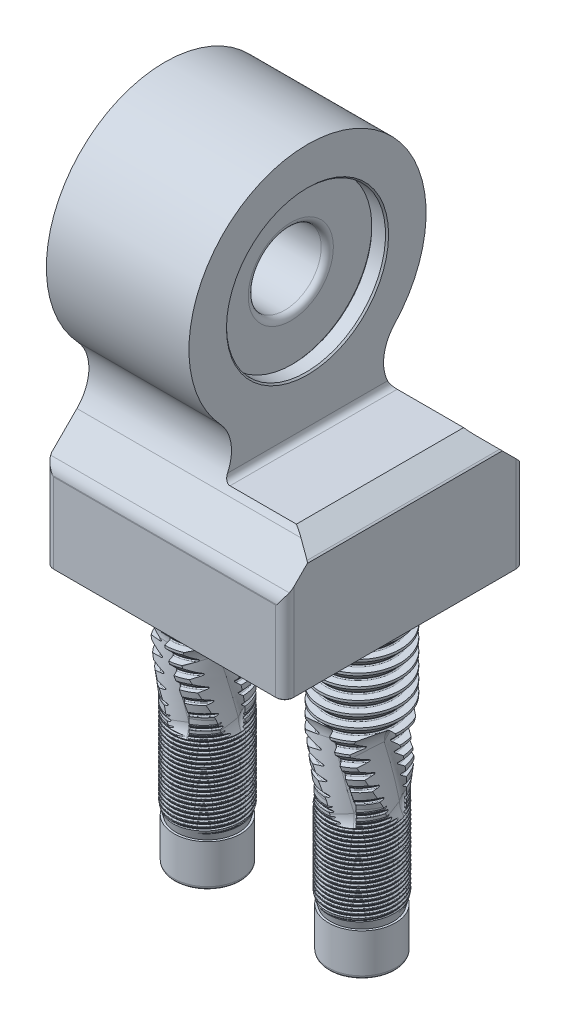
SolidWorks part; units mm, degrees
ref_plane "Front" through (0, 0, 0) normal (0, 0, 1) x (1, 0, 0)
ref_plane "Top" through (0, 0, 0) normal (0, 1, 0) x (1, 0, 0)
ref_plane "Right" through (0, 0, 0) normal (1, 0, 0) x (0, 0, -1)
imported_body "40X65 Pivot_Angle Bracket Stock Ext-15"
imported_body "40-6 Pivot Brackets Bearing 1/5200 Series Bearing"
imported_body "40-6 Pivot Brackets Bearing Bearing End Cap_32mm OD"
imported_body "40-6 Pivot Brackets Bearing Socket Countersunk Head Screw"
imported_body "40-6 Pivot Brackets Bearing Diametric Seal_32.5mm OD"
imported_body "40-6 Pivot Brackets Bearing 1/N5002-125 Beveled Retaining Ring"
imported_body "40-6 End Mount Threaded Insert-1"
imported_body "40-6 End Mount Threaded Insert Assm 2019-04-01-1/Large Head_Reduced Shank SHCS 2015-05-13-1-solid1"
imported_body "40-6 End Mount Threaded Insert-2"
imported_body "40-6 End Mount Threaded Insert Large Head Reduced Shank SHCS-2"
move or copy body "Body-Move/Copy1" bodies to move or copy 116 117 114 118 121 120 123 124 125 126 placed by mates yes
equation "\"Weight kg\"= round ( \"SW-Mass\" , 2 )"
equation "\"Weight lbs\"= round ( \"SW-Mass\" * 2.2046 , 2 )"
